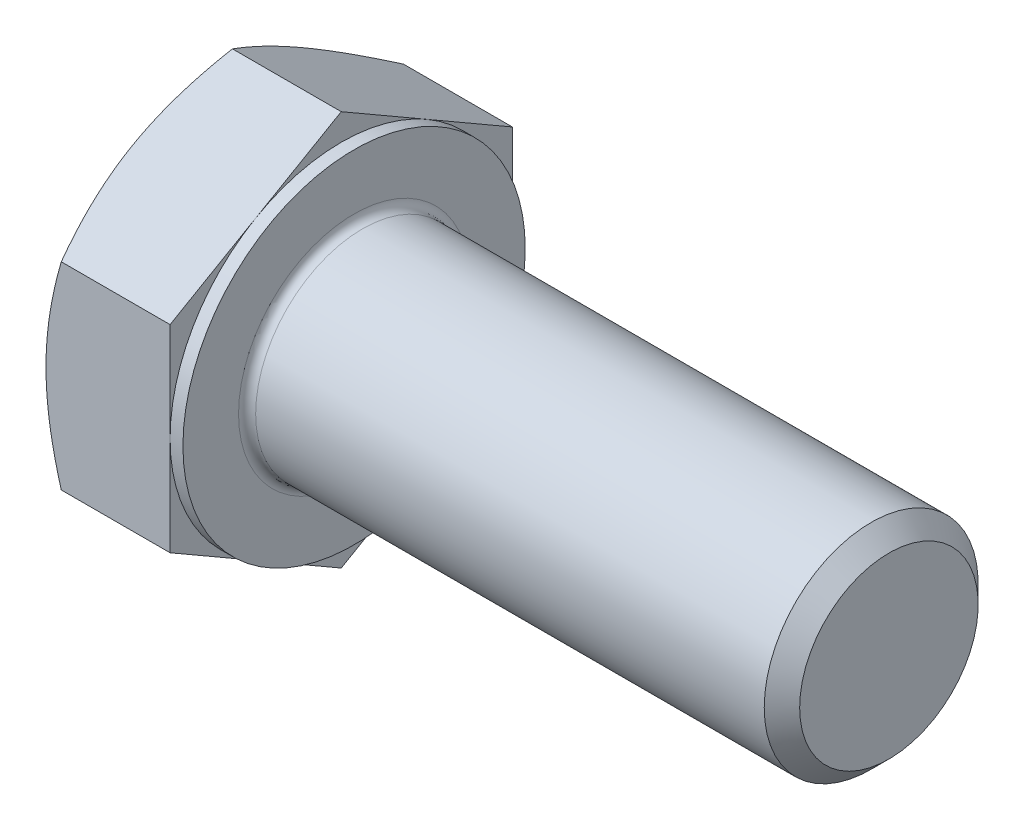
SolidWorks part; units mm, degrees
ref_plane "Plane1" through (0, 0, 0) normal (0, 0, 1) x (1, 0, 0)
ref_plane "Plane2" through (0, 0, 0) normal (0, 1, 0) x (1, 0, 0)
ref_plane "Plane3" through (0, 0, 0) normal (1, 0, 0) x (0, 0, -1)
sketch "Sketch1" plane through (0, 0, 0) normal (1, 0, 0) x (0, 0, -1)
  line L0 (8, 4.6188) -> (8, -4.6188)
  line L1 (-8, 4.6188) -> (-8, -4.6188)
  line L2 (8, -4.6188) -> (0, -9.2376)
  line L3 (0, -9.2376) -> (-8, -4.6188)
  line L4 (8, 4.6188) -> (0, 9.2376)
  line L5 (0, 9.2376) -> (-8, 4.6188)
  dimension "Width_flats" = 16
  dimension "D2" = 120
  dimension "D3" = 8
  dimension "D4" = 8
  dimension "D5" = 8
extrude "BaseHead" add sketch "Sketch1" along normal blind 6.4
sketch "BodySke" plane through (0, 0, 0) normal (0, 0, 1) x (1, 0, 0)
  line L0 (0, 4.6188) -> (0, -4.6188) construction
  line L1 (0, 0) -> (31.4, 0)
  line L2 (0, 0) -> (0, 5)
  line L3 (0, 5) -> (30.572, 5)
  line L4 (31.4, 0) -> (31.4, 4.172)
  line L5 (6.4, 9.2376) -> (6.4, 4.6188) construction
  line L6 (31.4, 4.172) -> (30.572, 5)
  line L7 (0, 0) -> (96.52, 0) construction
  line L8 (31.4, -4.172) -> (30.572, -5) construction
  line L9 (0, -5) -> (30.572, -5) construction
  line L10 (7.9, 15.24) -> (7.9, -1.27) construction
  line L12 (6.4, 4.6188) -> (6.4, -4.6188) construction
  dimension "Length" = 25
  dimension "Body_ch_ang" = 45
  dimension "Diameter" = 10
  dimension "Minor_dia" = 8.344
  dimension "Advance" = 1.5
revolve "BaseBody" add sketch "BodySke"
fillet "HeadFillet" radius 0.4 1 edges at (6.4, 0, -5)
sketch "Sketch3" plane through (0, 0, 0) normal (0, 0, 1) x (1, 0, 0)
  line L0 (0, 8) -> (3.6013, 14.2376)
  line L1 (0, 9.2376) -> (0, 4.6188) construction
  line L2 (3.6013, 14.2376) -> (3.6013, 19.2376)
  line L3 (3.6013, 19.2376) -> (-10, 19.2376)
  line L4 (-10, 19.2376) -> (-10, 8)
  line L5 (-10, 8) -> (0, 8)
  line L6 (0, 0) -> (99.06, 0) construction
  line L7 (6.4, 9.2376) -> (0, 9.2376) construction
  dimension "D1" = 8
  dimension "D2" = 5
  dimension "D3" = 10
  dimension "D4" = 5
  dimension "Head_ch_ang" = 30
revolve "HeadChamfer" cut sketch "Sketch3" angle 360 about L6
sketch "Sketch4" plane through (0, 0, 0) normal (0, 0, 1) x (1, 0, 0)
  line L1 (6.4, 9.2376) -> (6.4, 4.6188) construction
  line L2 (6.4, 8) -> (5.8, 8)
  line L3 (6.4, 8) -> (6.4, 19.2376)
  line L4 (6.4, 19.2376) -> (5.8, 19.2376)
  line L5 (0, 0) -> (95.25, 0) construction
  line L6 (0, 0) -> (96.52, 0) construction
  line L7 (5.8, 8) -> (5.8, 19.2376)
  line L8 (6.4, 9.2376) -> (0.7145, 9.2376) construction
  dimension "D1" = 16
  dimension "D2" = 10
  dimension "Bearing_ht" = 0.6
revolve "BearingFace" cut sketch "Sketch4" angle 360 about L5
sketch "ThdSchSke" plane through (0, 0, 0) normal (0, 0, 1) x (1, 0, 0)
  line L0 (7.9, -4.172) -> (7.3202, -5)
  line L1 (7.9, -4.172) -> (8.4798, -5)
  line L2 (8.4798, -5) -> (8.4798, -6.25)
  line L3 (-3.175, 0) -> (5.1513, 0) construction
  line L5 (8.4798, -6.25) -> (7.3202, -6.25)
  line L6 (7.3202, -6.25) -> (7.3202, -5)
  dimension "Thread_minor" = 8.344
  dimension "Diameter" = 10
  dimension "Start" = 7.9
  dimension "SideAngle" = 55
  dimension "VeeAngle" = 70
  dimension "Overcut" = 12.5
revolve "ThreadSchematic" [suppressed] cut sketch "ThdSchSke" angle 360 about L3
pattern_linear "ThdSchPat" [suppressed]
equation "\"D3@Sketch1\" = \"Width_flats@Sketch1\" / 2"
equation "\"D4@Sketch1\" = \"D3@Sketch1\""
equation "\"D5@Sketch1\" = \"D4@Sketch1\""
equation "\"Thread_minor@ThreadCosmetic\" = \"Minor_dia@BodySke\""
equation "\"D1@Sketch3\" = \"Width_flats@Sketch1\" / 2"
equation "\"D1@Sketch4\" = \"Width_flats@Sketch1\""
equation "\"Thread_length@ThreadCosmetic\" = \"Length@BodySke\" - \"Advance@BodySke\""
equation "\"Thread_minor@ThdSchSke\" = \"Minor_dia@BodySke\""
equation "\"Diameter@ThdSchSke\" = \"Diameter@BodySke\""
equation "\"Overcut@ThdSchSke\" = \"Diameter@BodySke\" * 1.25"
equation "\"Start@ThdSchSke\" = \"Head_ht@BaseHead\" + \"Length@BodySke\" - \"Thread_length@ThreadCosmetic\"  '---Non-countersunk---"
equation "\"Num_threads@ThdSchPat\" = int( \"Thread_length@ThreadCosmetic\" / \"Advance@BodySke\" + 0.999 )  + 1"
equation "\"Advance@ThdSchPat\" = \"Thread_length@ThreadCosmetic\" /  (\"Num_threads@ThdSchPat\" - 1) 'relax it"
equation "\"Num_threads@ThdSchPat\" = \"Num_threads@ThdSchPat\" - sgn( \"Num_threads@ThdSchPat\" - 1) '---chamfered tips only---"
